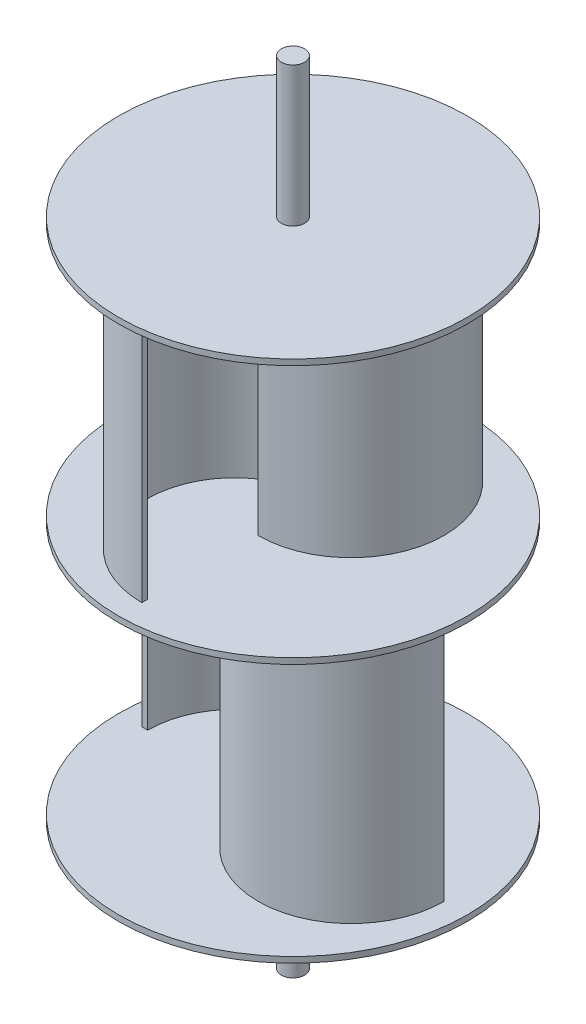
SolidWorks part; units mm, degrees
ref_plane "Front Plane" through (0, 0, 0) normal (0, 0, 1) x (1, 0, 0)
ref_plane "Top Plane" through (0, 0, 0) normal (0, 1, 0) x (1, 0, 0)
ref_plane "Right Plane" through (0, 0, 0) normal (1, 0, 0) x (0, 0, -1)
sketch "Sketch1" plane through (0, 0, 0) normal (0, 1, 0) x (1, 0, 0)
  circle A0 centre (0, 0) radius 150
  dimension "D1" = 300
extrude "Boss-Extrude1" add sketch "Sketch1" along normal blind 5
sketch "Sketch2" plane through (0, 5, 0) normal (0, 1, 0) x (1, 0, 0)
  line L0 (-150, 0) -> (150, 0) construction
  circle A0 centre (0, 0) radius 150 construction
  circle A1 centre (0, 0) radius 10
  arc A2 (25, 0) -> (-125, 0) centre (-50, 0) ccw
  circle A3 centre (0, 0) radius 125 construction
  arc A5 (-25, 0) -> (125, 0) centre (50, 0) ccw
  point P15 (-125, 0)
  point P19 (125, 0)
  dimension "D1" = 250
  dimension "D2" = 75
  dimension "D3" = 75
  dimension "D4" = 20
extrude "Extrude-Thin1" add sketch "Sketch2" along normal blind 217.5 thin contours A2 | A5
sketch "Sketch3" plane through (0, 5, 0) normal (0, 1, 0) x (1, 0, 0)
  circle A0 centre (0, 0) radius 10 construction
  circle A1 centre (0, 0) radius 10
extrude "Boss-Extrude2" add sketch "Sketch3" along normal blind 435
sketch "Sketch4" plane through (0, 222.5, 0) normal (0, 1, 0) x (1, 0, 0)
  circle A1 centre (0, 0) radius 150
  circle A2 centre (0, 0) radius 150
  dimension "D1" = 0
extrude "Boss-Extrude3" add sketch "Sketch4" along normal blind 5
sketch "Sketch5" plane through (0, 227.5, 0) normal (0, 1, 0) x (1, 0, 0)
  line L0 (0, 150) -> (0, -150) construction
  circle A0 centre (0, 0) radius 150 construction
  circle A1 centre (0, 0) radius 125 construction
  circle A2 centre (0, 0) radius 125 construction
  arc A3 (0, -25) -> (0, 125) centre (0, 50) ccw
  arc A4 (0, 25) -> (0, -125) centre (0, -50) ccw
  point P9 (0, 125)
  point P14 (0, -125)
  dimension "D1" = 75
  dimension "D2" = 75
extrude "Extrude-Thin2" add sketch "Sketch5" along normal blind 217.5 thin
sketch "Sketch6" plane through (0, 445, 0) normal (0, 1, 0) x (1, 0, 0)
  circle A1 centre (0, 0) radius 150
  circle A2 centre (0, 0) radius 150
  dimension "D1" = 0
extrude "Boss-Extrude4" add sketch "Sketch6" along normal blind 5
sketch "Sketch7" plane through (0, 450, 0) normal (0, 1, 0) x (1, 0, 0)
  circle A0 centre (0, 0) radius 10
  dimension "D1" = 20
extrude "Boss-Extrude5" add sketch "Sketch7" along normal blind 120 and the other way blind 560
